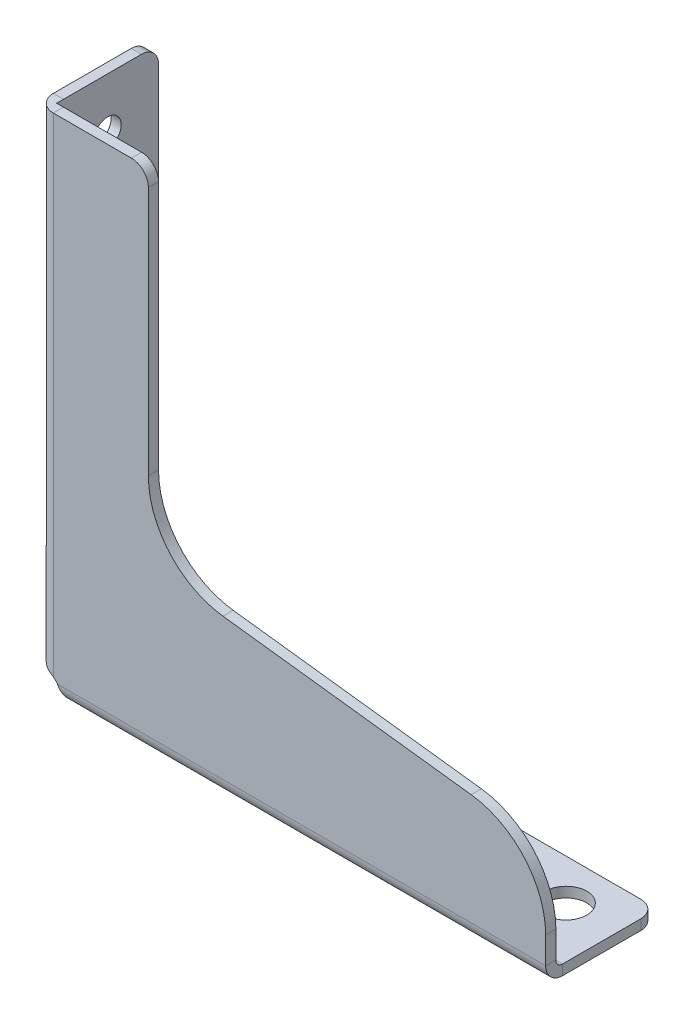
SolidWorks part; units mm, degrees
ref_plane "正面" through (0, 0, 0) normal (0, 0, 1) x (1, 0, 0)
ref_plane "平面" through (0, 0, 0) normal (0, 1, 0) x (1, 0, 0)
ref_plane "右側面" through (0, 0, 0) normal (1, 0, 0) x (0, 0, -1)
sketch "ｽｹｯﾁ1" plane through (0, 0, 0) normal (0, 0, 1) x (1, 0, 0)
  line L0 (114.2253, 30.6675) -> (41.1318, 39.6422)
  line L1 (-42.3215, 142.9719) -> (19.1785, 142.9719)
  line L2 (-10.8215, -35.5281) -> (-10.8215, -13.6953)
  line L3 (136.1785, 5.8538) -> (136.1785, -35.5281)
  line L4 (-42.3215, 142.9719) -> (-42.3215, -4.0281)
  line L5 (-42.3215, -4.0281) -> (-20.4887, -4.0281)
  line L6 (19.1785, 142.9719) -> (19.1785, 64.4559)
  line L9 (-10.8215, -35.5281) -> (136.1785, -35.5281)
  line L10 (-42.3215, -4.0281) -> (19.1785, -4.0281) construction
  arc A0 (41.1318, 39.6422) -> (19.1785, 64.4559) centre (44.1785, 64.4559) cw
  arc A1 (136.1785, 5.8538) -> (114.2253, 30.6675) centre (111.1785, 5.8538) ccw
  arc A2 (-10.8215, -13.6953) -> (-20.4887, -4.0281) centre (-13.4731, -6.6797) ccw
  dimension "D1" = 31.5
  dimension "D8" = 97
  dimension "D10" = 25
  dimension "D3" = 25
  dimension "D2" = 147
  dimension "D4" = 31.5
  dimension "D5" = 61.5
  dimension "D6" = 147
sheet metal parameters "板金1" thickness 3 parameters "D1"=0.7366
base flange "ﾍﾞｰｽ-ﾌﾗﾝｼﾞ1" sketch "ｽｹｯﾁ1" thickness 3 reverse thickness direction yes parameters "D1"=0.7366
sketch "ｽｹｯﾁ13" plane through (0, 0, 0) normal (0, 0, -1) x (-1, 0, 0)
  line L2 (10.8215, -13.6953) -> (10.8215, -35.5281) construction
  line L3 (13.8215, 123.4829) -> (13.8215, 41.897)
  dimension "D1" = 3
sketched bend "ｽｹｯﾁ ﾍﾞﾝﾄﾞ1" parameters "D1"=2
bend "ｽｹｯﾁﾍﾞﾝﾄﾞ3" bend radius 2 bend angle 90 parameters "D5"=3
sketch "ｽｹｯﾁ14" plane through (4.4978, 0, 0) normal (0, 0, -1) x (-1, 0, 0)
  line L1 (9.1853, -7.0281) -> (-128.3526, -7.0281)
  line L3 (18.3193, -4.0281) -> (15.3193, -4.0281) construction
  dimension "D1" = 3
sketched bend "ｽｹｯﾁ ﾍﾞﾝﾄﾞ2" parameters "D1"=2
bend "ｽｹｯﾁﾍﾞﾝﾄﾞ2" bend radius 2 bend angle 90 parameters "D5"=2
hole_wizard "Ø12.2 (12.2) 直径の穴1" positions "3Dｽｹｯﾁ1" profile "ｽｹｯﾁ8" hole size "Ø12.2" standard "Jis"
sketch3d "3Dｽｹｯﾁ1"
  line L3 (136.1785, -4.0281, -30.0022) -> (136.1785, -4.0281, -2) construction
  line L4 (-10.8215, -4.0281, -30.0022) -> (136.1785, -4.0281, -30.0022) construction
  point P30 (61.1785, -4.0281, -18.0022)
  point P32 (121.1785, -4.0281, -18.0022)
  dimension "D1" = 15
  dimension "D2" = 12
  dimension "D3" = 60
sketch "ｽｹｯﾁ8" plane through (61.1785, -4.0281, -18.0022) normal (1, 0, 0) x (0, 0, 1)
  line L0 (0, 0) -> (0, 39.6652)
  line L1 (0, 39.6652) -> (6.1, 36)
  line L2 (6.1, 36) -> (6.1, 0)
  line L5 (6.1, 0) -> (0, 0)
  line L10 (0, 39.6652) -> (-6.1, 36) construction
  line L11 (0, -6.35) -> (0, 107.95) construction
  dimension "穴の直径" = 12.2
  dimension "穴の深さ" = 36
  dimension "ﾄﾞﾘﾙ角度" = 118
hole_wizard "Ø8.0 (8) 直径の穴1" positions "ｽｹｯﾁ16" profile "ｽｹｯﾁ15" hole size "Ø8.0" standard "Jis"
sketch "ｽｹｯﾁ16" plane through (-10.8215, 0, 0) normal (1, 0, 0) x (0, 0, -1)
  line L0 (30.0022, 142.9719) -> (30.0022, -4.0281) construction
  line L1 (2, 142.9719) -> (30.0022, 142.9719) construction
  point P0 (15.0022, 127.9719)
  point P2 (15.0022, 47.9719)
  dimension "D1" = 15
  dimension "D2" = 15
  dimension "D3" = 80
sketch "ｽｹｯﾁ15" plane through (-10.8215, 127.9719, -15.0022) normal (0, 1, 0) x (0, 0, -1)
  line L0 (0, 0) -> (0, 38.4034)
  line L1 (0, 38.4034) -> (4, 36)
  line L2 (4, 36) -> (4, 0)
  line L5 (4, 0) -> (0, 0)
  line L10 (0, 38.4034) -> (-4, 36) construction
  line L11 (0, -6.35) -> (0, 107.95) construction
  dimension "穴の直径" = 8
  dimension "穴の深さ" = 36
  dimension "ﾄﾞﾘﾙ角度" = 118
fillet "ﾌｨﾚｯﾄ1" radius 5 5 edges at (136.1785, -5.5281, -30.0022) (-10.8215, -5.5281, -30.0022) (-12.3215, -4.0281, -30.0022) (19.1785, 142.9719, 1.5) (-12.3215, 142.9719, -30.0022)
sketch "ｽｹｯﾁ17" plane through (0, 142.9719, 0) normal (0, 1, 0) x (1, 0, 0)
  line L0 (-10.8215, 2) -> (-10.8215, 0)
  line L1 (-8.8215, 0) -> (-10.8215, 0)
  line L2 (14.1785, 0) -> (-8.8215, 0) construction
  line L3 (-10.8215, 2) -> (-10.8215, 25.0022) construction
  arc A0 (-10.8215, 2) -> (-8.8215, 0) centre (-8.8215, 2) ccw construction
  arc A1 (-10.8215, 2) -> (-8.8215, 0) centre (-8.8215, 2) ccw
extrude "ｶｯﾄ - 押し出し1" cut sketch "ｽｹｯﾁ17" against normal up to next
flat pattern "ﾌﾗｯﾄ-ﾊﾟﾀｰﾝ1"
sketch "ﾍﾞﾝﾄﾞ-ﾗｲﾝ1" plane through (0, 0, 0) normal (0, 1, 0) x (-1, 0, 0)
bend of the flat pattern "ﾌﾗｯﾄ-<ｽｹｯﾁﾍﾞﾝﾄﾞ2>1"
bend of the flat pattern "ﾌﾗｯﾄ-<ｽｹｯﾁﾍﾞﾝﾄﾞ3>1"
